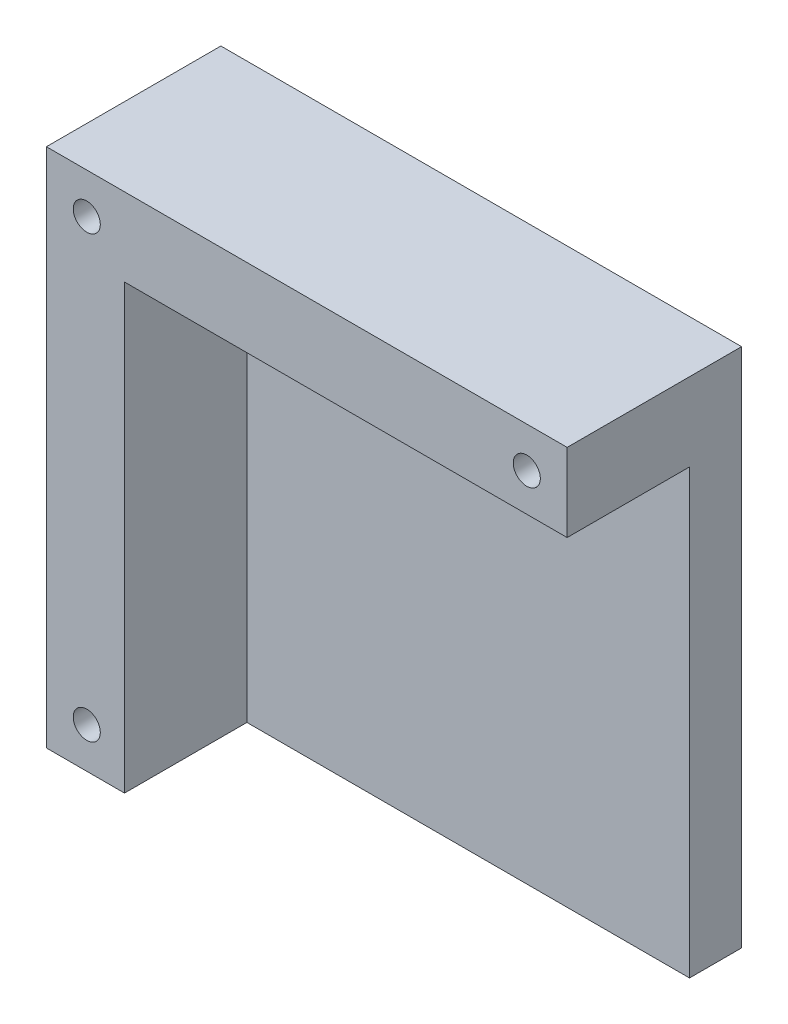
SolidWorks part; units mm, degrees
ref_plane "Plan de face" through (0, 0, 0) normal (0, 0, 1) x (1, 0, 0)
ref_plane "Plan de dessus" through (0, 0, 0) normal (0, 1, 0) x (1, 0, 0)
ref_plane "Plan de droite" through (0, 0, 0) normal (1, 0, 0) x (0, 0, -1)
sketch "Esquisse1" plane through (0, 0, 0) normal (0, 0, 1) x (1, 0, 0)
  line L1 (-59.9893, 29.8525) -> (40.0107, 29.8525)
  line L2 (-59.9893, 29.8525) -> (-59.9893, -70.1475)
  line L3 (-59.9893, -70.1475) -> (40.0107, -70.1475)
  line L4 (40.0107, 29.8525) -> (40.0107, -70.1475)
  dimension "D1" = 100
  dimension "D2" = 100
extrude "Boss.-Extru.1" add sketch "Esquisse1" along normal blind 33.5
sketch "Esquisse2" plane through (0, 0, 33.5) normal (0, 0, 1) x (1, 0, 0)
  line L1 (40.0107, -70.1475) -> (-44.9893, -70.1475)
  line L2 (40.0107, -70.1475) -> (40.0107, 14.8525)
  line L3 (40.0107, 14.8525) -> (-44.9893, 14.8525)
  line L4 (-44.9893, -70.1475) -> (-44.9893, 14.8525)
  line L5 (-59.9893, 29.8525) -> (-59.9893, -70.1475) construction
  line L6 (40.0107, 29.8525) -> (-59.9893, 29.8525) construction
  dimension "D1" = 15
  dimension "D3" = 15
extrude "Enlèv. mat.-Extru.1" cut sketch "Esquisse2" against normal blind 23.5
sketch "Esquisse3" plane through (0, 0, 0) normal (0, 0, 1) x (1, 0, 0)
  line L0 (-59.9893, 29.8525) -> (-59.9893, -70.1475) construction
  line L1 (-59.9893, -70.1475) -> (-44.9893, -70.1475) construction
  line L2 (40.0107, 29.8525) -> (-59.9893, 29.8525) construction
  line L3 (40.0107, 14.8525) -> (40.0107, 29.8525) construction
  circle A0 centre (32.2607, 22.1025) radius 2.6
  circle A1 centre (-52.2393, -62.3975) radius 2.6
  circle A2 centre (-52.2393, 22.1025) radius 2.6
  dimension "D1" = 5.2
  dimension "D2" = 5.2
  dimension "D7" = 5.2
  dimension "D3" = 7.75
  dimension "D4" = 7.75
  dimension "D5" = 7.75
  dimension "D6" = 7.75
  dimension "D8" = 7.75
extrude "Enlèv. mat.-Extru.4" cut sketch "Esquisse3" along normal blind 40
